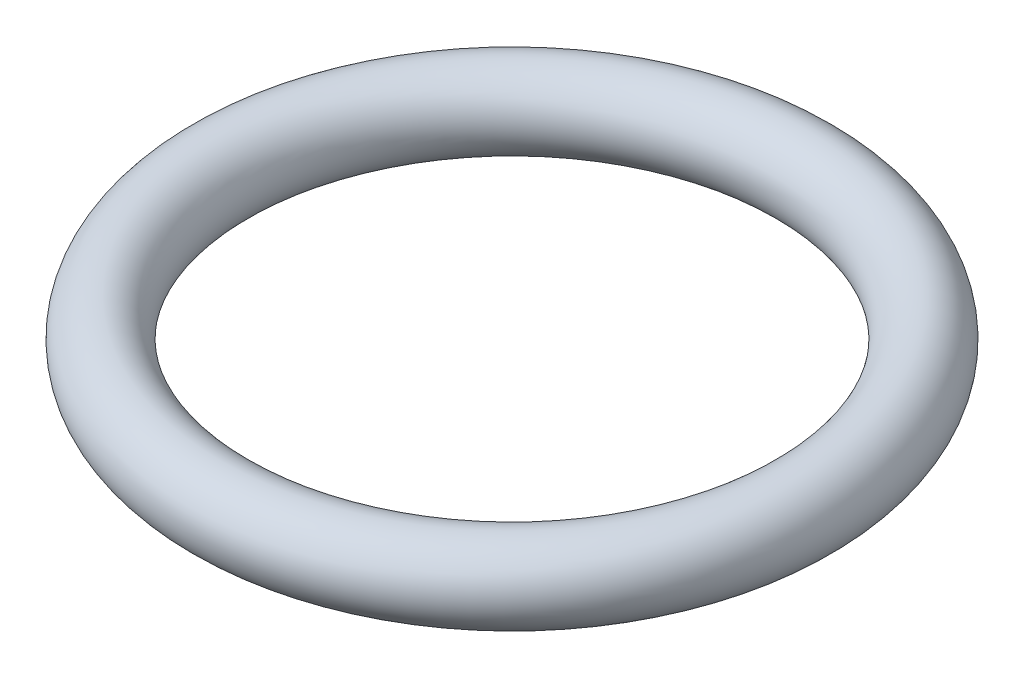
SolidWorks part; units mm, degrees
ref_plane "Front" through (0, 0, 0) normal (0, 0, 1) x (1, 0, 0)
ref_plane "Top" through (0, 0, 0) normal (0, 1, 0) x (1, 0, 0)
ref_plane "Right" through (0, 0, 0) normal (1, 0, 0) x (0, 0, -1)
sketch "Sketch1" plane through (0, 0, 0) normal (1, 0, 0) x (0, 0, -1)
  line L0 (0, 0) -> (0, 13.9892) construction
  circle A0 centre (9.8679, 0) radius 1.3081
  dimension "C.S." = 2.6162
  dimension "I.D." = 17.1196
revolve "Revolve1" add sketch "Sketch1" angle 360 about L0
